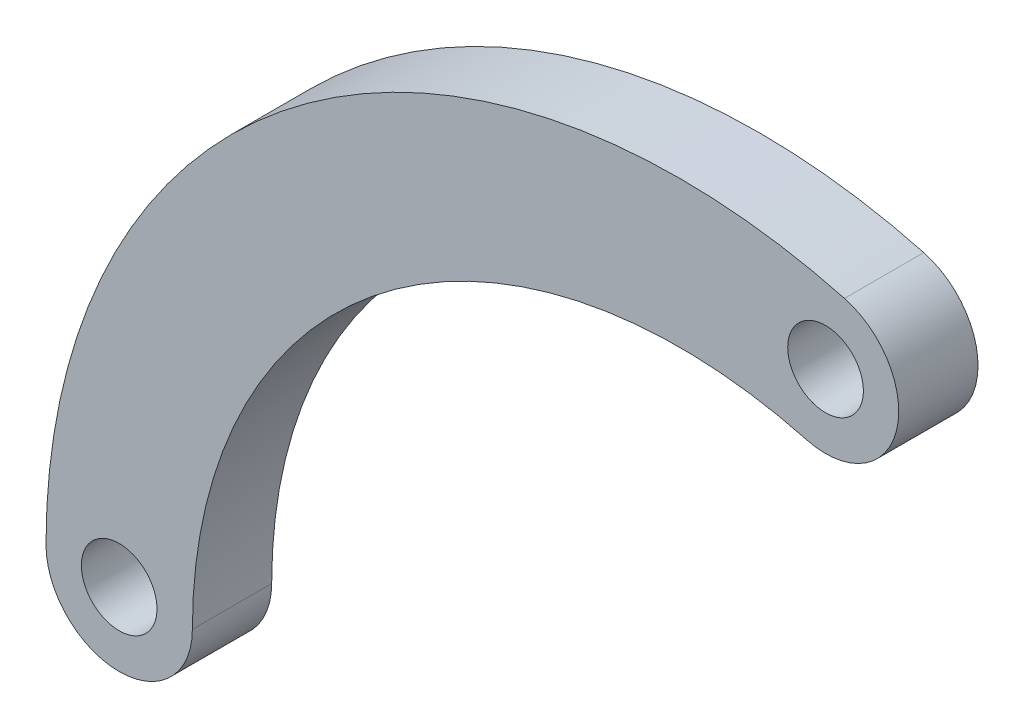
SolidWorks part; units mm, degrees
ref_plane "Frontal" through (0, 0, 0) normal (0, 0, 1) x (1, 0, 0)
ref_plane "Horizontal" through (0, 0, 0) normal (0, 1, 0) x (1, 0, 0)
ref_plane "Vertical" through (0, 0, 0) normal (1, 0, 0) x (0, 0, -1)
sketch "Esquisse1" plane through (0, 0, 0) normal (0, 0, 1) x (1, 0, 0)
  line L0 (0, 0) -> (-105.0833, 0) construction
  line L1 (0, 0) -> (33.576, 125.3072) construction
  arc A0 (-52, 0) -> (13.4586, 50.2281) centre (0, 0) cw
  arc A1 (10.3528, 38.637) -> (-40, 0) centre (0, 0) ccw
  arc A2 (13.4586, 50.2281) -> (10.3528, 38.637) centre (11.9057, 44.4326) cw
  arc A3 (-52, 0) -> (-40, 0) centre (-46, 0) ccw
  arc A4 (-46, 0) -> (11.9057, 44.4326) centre (0, 0) cw construction
  circle A5 centre (11.9057, 44.4326) radius 3.1
  circle A6 centre (-46, 0) radius 3.1
  dimension "D2" = 52
  dimension "D3" = 40
  dimension "D4" = 6.2
  dimension "D5" = 6.2
  dimension "D1" = 105
extrude "Extrusion1" add sketch "Esquisse1" along normal blind 6.5
